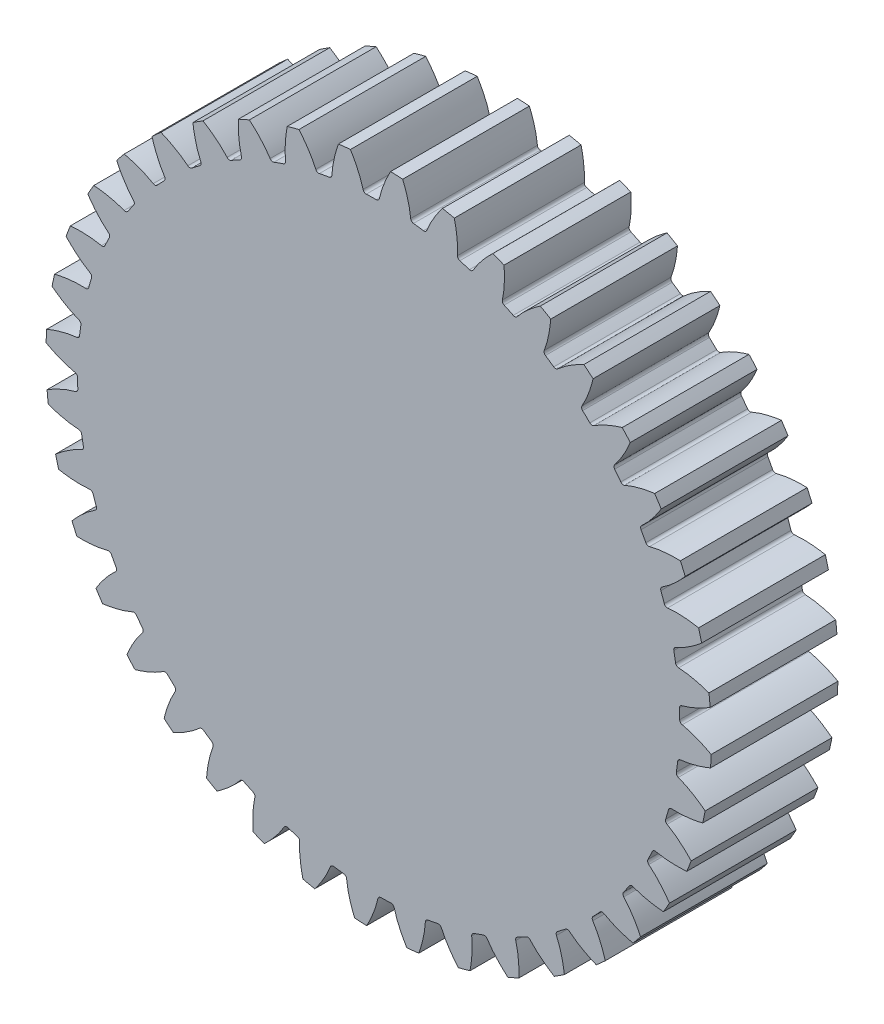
SolidWorks part; units mm, degrees
ref_plane "Płaszczyzna przednia" through (0, 0, 0) normal (0, 0, 1) x (1, 0, 0)
ref_plane "Płaszczyzna górna" through (0, 0, 0) normal (0, 1, 0) x (1, 0, 0)
ref_plane "Płaszczyzna prawa" through (0, 0, 0) normal (1, 0, 0) x (0, 0, -1)
sketch "Szkic1" plane through (0, 0, 0) normal (0, 0, 1) x (1, 0, 0)
  line L0 (0, 0) -> (-93.9693, 0) construction
  circle A0 centre (0, 0) radius 93.9693 construction
  spline S0 degree 4 poles (0, 93.9693) (0.0015, 94.0387) (0.0101, 94.2334) (0.0445, 94.6007) (0.126, 95.1975) (0.267, 95.9534) (0.4917, 96.9232) (0.8105, 98.0546) (1.2174, 99.2846) (1.7197, 100.6057) (2.2738, 101.9074) (2.8741, 103.1883) (3.5163, 104.4488) (4.3424, 105.9534) (5.406, 107.7297) (6.741, 109.7534) (8.3808, 111.9958) (10.1543, 114.2008) (12.0208, 116.3274) (13.7282, 118.1203) (15.2401, 119.609) (16.5303, 120.8179) (17.5798, 121.7661) (18.9128, 122.9278) (20.2722, 124.0581) (21.6573, 125.1577) (23.347, 126.4399) (24.6361, 127.3747) (25.7945, 128.1829) (26.8233, 128.877) (27.3989, 129.2594) (28.1628, 129.7572) (28.7771, 130.1498) (29.8873, 130.847) (30.7127, 131.3425) (31.6087, 131.8792) (32.0316, 132.1195) (32.3237, 132.29) knots 0 0 0 0 0 0.005377 0.015084 0.028532 0.04661 0.064855 0.092111 0.119476 0.146842 0.174209 0.201575 0.228941 0.256307 0.307035 0.361767 0.4165 0.471232 0.525964 0.580697 0.608063 0.635429 0.662795 0.690161 0.744894 0.77226 0.799626 0.854358 0.868042 0.881725 0.895408 0.909091 0.931818 0.954545 0.977273 1 1 1 1 1 construction
  spline S1 degree 4 poles (0, 93.9693) (0.0015, 94.0387) (0.0101, 94.2334) (0.0445, 94.6007) (0.126, 95.1975) (0.267, 95.9534) (0.4917, 96.9232) (0.8105, 98.0546) (1.2174, 99.2846) (1.7197, 100.6057) (2.2738, 101.9074) (2.8741, 103.1883) (3.5163, 104.4488) (4.3424, 105.9534) (5.406, 107.7297) (6.741, 109.7534) (8.3808, 111.9958) (10.1543, 114.2008) (12.0208, 116.3274) (13.7282, 118.1203) (15.2401, 119.609) (16.5303, 120.8179) (17.5798, 121.7661) (18.9128, 122.9278) (20.2722, 124.0581) (21.6573, 125.1577) (23.347, 126.4399) (24.6361, 127.3747) (25.7945, 128.1829) (26.8233, 128.877) (27.3989, 129.2594) (27.8906, 129.5798) (28.1654, 129.7573) (28.3006, 129.8442) knots 0 0 0 0 0 0.005377 0.015084 0.028532 0.04661 0.064855 0.092111 0.119476 0.146842 0.174209 0.201575 0.228941 0.256307 0.307035 0.361767 0.4165 0.471232 0.525964 0.580697 0.608063 0.635429 0.662795 0.690161 0.744894 0.77226 0.799626 0.854358 0.868042 0.881725 0.895408 0.909091 0.909091 0.909091 0.909091 0.909091
sketch "Szkic2" plane through (0, 0, 0) normal (0, 0, 1) x (1, 0, 0)
  circle A0 centre (0, 0) radius 105
extrude "Dodanie-wyciągnięcie1" add sketch "Szkic2" along normal blind 40
sketch "Szkic3" plane through (0, 0, 40) normal (0, 0, 1) x (1, 0, 0)
  line L0 (0, 0) -> (-2.4362, 99.9703) construction
  arc A0 (1.4904, 99.9889) -> (-6.359, 99.7976) centre (0, 0) ccw construction
  arc A1 (0.1024, 94.9999) -> (-4.7297, 94.8822) centre (0, 0) ccw
  circle A2 centre (0, 0) radius 105 construction
  arc A3 (3.7858, 104.9317) -> (-8.8925, 104.6228) centre (0, 0) ccw
  spline S0 degree 4 poles (999.9083, 80.4305) (29.6931, 84.0474) (0.578, 87.737) (-0.3869, 91.4411) (0.126, 95.1975) (0.267, 95.9534) (0.4917, 96.9232) (0.8105, 98.0546) (1.2174, 99.2846) (1.7197, 100.6057) (2.2738, 101.9074) (2.8741, 103.1883) (3.5163, 104.4488) (4.3424, 105.9534) (5.406, 107.7297) (6.741, 109.7534) (8.3808, 111.9958) (10.1543, 114.2008) (12.0208, 116.3274) (13.7282, 118.1203) (15.2401, 119.609) (16.5303, 120.8179) (17.5798, 121.7661) (18.9128, 122.9278) (20.2722, 124.0581) (21.6573, 125.1577) (23.347, 126.4399) (24.6361, 127.3747) (25.7945, 128.1829) (26.8233, 128.877) (29.3599, 130.5619) (33.5926, 133.1853) (1.2449, 112.2039) (869.9252, 669.6753) knots -0.246751 -0.246751 -0.246751 -0.246751 -0.246751 0.005377 0.015084 0.028532 0.04661 0.064855 0.092111 0.119476 0.146842 0.174209 0.201575 0.228941 0.256307 0.307035 0.361767 0.4165 0.471232 0.525964 0.580697 0.608063 0.635429 0.662795 0.690161 0.744894 0.77226 0.799626 0.854358 0.868042 0.881725 0.895408 1.095536 1.095536 1.095536 1.095536 1.095536 only from (0, 93.9693) to (28.3006, 129.8442) construction
  spline S1 degree 4 poles (0.1024, 94.9999) (0.1186, 95.1083) (0.1728, 95.4471) (0.2815, 96.0159) (0.4917, 96.9232) (0.8105, 98.0546) (1.2174, 99.2846) (1.7197, 100.6057) (2.2738, 101.9074) (2.8577, 103.1534) (3.3208, 104.0649) (3.6352, 104.655) (3.7858, 104.9317) knots 0.020053 0.020053 0.020053 0.020053 0.020053 0.028532 0.04661 0.064855 0.092111 0.119476 0.146842 0.174209 0.201575 0.225957 0.225957 0.225957 0.225957 0.225957
  spline S2 degree 4 poles (-4.7297, 94.8822) (-4.7511, 94.9896) (-4.8218, 95.3254) (-4.958, 95.8882) (-5.2122, 96.7842) (-5.5858, 97.8988) (-6.052, 99.1075) (-6.6181, 100.4025) (-7.2349, 101.6756) (-7.8788, 102.8918) (-8.3857, 103.7797) (-8.7286, 104.3537) (-8.8925, 104.6228) knots 0.020053 0.020053 0.020053 0.020053 0.020053 0.028532 0.04661 0.064855 0.092111 0.119476 0.146842 0.174209 0.201575 0.225957 0.225957 0.225957 0.225957 0.225957
extrude "Wytnij-wyciągnięcie1" cut sketch "Szkic3" against normal through all contours S2 A3 S1 A1
fillet "Zaokrąglenie1" radius 1 2 edges at (0.1024, 94.9999, 20) (-4.7297, 94.8822, 20)
pattern_circular "Szyk kołowy1" count 40 over 360 about axis through (0, 0, 40) along (0, 0, -1) of "Wytnij-wyciągnięcie1", "Zaokrąglenie1"
sketch "Szkic4" [suppressed] plane through (0, 0, 40) normal (0, 0, 1) x (1, 0, 0)
  line L0 (0, 0) -> (-3.904, 53.8587) construction
  line L1 (-7.3179, 50.213) -> (0, 50.7434)
  arc A0 (4.0821, 59.861) -> (-12.6723, 58.6465) centre (0, 0) ccw
  arc A1 (0.8048, 53.994) -> (-8.5831, 53.3135) centre (0, 0) ccw construction
  circle A2 centre (0, 0) radius 48 construction
  spline S0 degree 4 poles (1999.8117, 39.8954) (40.5779, 43.1261) (0.7793, 45.9501) (-0.3009, 48.7046) (0.068, 51.4067) (0.1442, 51.8148) (0.2655, 52.3385) (0.4377, 52.9495) (0.6574, 53.6137) (0.9286, 54.3271) (1.2278, 55.03) (1.552, 55.7217) (1.8988, 56.4023) (2.3449, 57.2148) (2.9192, 58.174) (3.6402, 59.2669) (4.5256, 60.4777) (5.4834, 61.6685) (6.491, 62.8166) (7.4136, 63.7852) (8.2291, 64.5885) (8.9273, 65.2423) (9.4914, 65.7526) (10.2164, 66.3833) (10.941, 66.9876) (11.7034, 67.5906) (12.594, 68.2689) (13.4071, 68.8553) (16.247, 70.8396) (22.2811, 74.4519) (-32.9346, 38.4752) (1698.6965, 1149.6096) knots -0.344173 -0.344173 -0.344173 -0.344173 -0.344173 0.005377 0.015084 0.028532 0.04661 0.064855 0.092111 0.119476 0.146842 0.174209 0.201575 0.228941 0.256307 0.307035 0.361767 0.4165 0.471232 0.525964 0.580697 0.608063 0.635429 0.662795 0.690161 0.744894 0.77226 0.799626 0.854358 0.881725 1.316021 1.316021 1.316021 1.316021 1.316021 only from (0, 50.7434) to (15.2823, 70.1159) construction
  spline S1 degree 4 poles (0, 50.7434) (0.0008, 50.7809) (0.0055, 50.8861) (0.024, 51.0844) (0.068, 51.4067) (0.1442, 51.8148) (0.2655, 52.3385) (0.4377, 52.9495) (0.6574, 53.6137) (0.9286, 54.3271) (1.2278, 55.03) (1.552, 55.7217) (1.8988, 56.4023) (2.3449, 57.2148) (2.9192, 58.174) (3.4304, 58.9489) (3.8556, 59.5508) (4.0815, 59.8601) (4.0821, 59.861) knots 0 0 0 0 0 0.005377 0.015084 0.028532 0.04661 0.064855 0.092111 0.119476 0.146842 0.174209 0.201575 0.228941 0.256307 0.307035 0.361767 0.361924 0.361924 0.361924 0.361924 0.361924
  spline S2 degree 4 poles (-7.3179, 50.213) (-7.3241, 50.25) (-7.3439, 50.3533) (-7.3909, 50.5469) (-7.4809, 50.8595) (-7.6151, 51.2524) (-7.8107, 51.7531) (-8.0692, 52.3329) (-8.3824, 52.9584) (-8.7537, 53.6253) (-9.1511, 54.2776) (-9.5716, 54.9154) (-10.013, 55.5389) (-10.5716, 56.2786) (-11.2782, 57.1449) (-11.8958, 57.838) (-12.4033, 58.3723) (-12.6715, 58.6457) (-12.6723, 58.6465) knots 0 0 0 0 0 0.005377 0.015084 0.028532 0.04661 0.064855 0.092111 0.119476 0.146842 0.174209 0.201575 0.228941 0.256307 0.307035 0.361767 0.361924 0.361924 0.361924 0.361924 0.361924
extrude "Wytnij-wyciągnięcie2" [suppressed] cut sketch "Szkic4" against normal through all
sketch "Szkic5" [suppressed] plane through (0, 0, 40) normal (0, 0, 1) x (1, 0, 0)
  line L0 (-7.3179, 50.213) -> (0, 50.7434) construction
  line L1 (-7.3179, 50.213) -> (0, 50.7434)
  arc A2 (-7.3179, 50.213) -> (-4.4598, 47.7924) centre (-4.7033, 50.4025) ccw
  circle A3 centre (0, 0) radius 48 construction
  arc A4 (0, 50.7434) -> (-2.4792, 47.9359) centre (-2.6146, 50.5539) cw
  arc A5 (-4.4598, 47.7924) -> (-2.4792, 47.9359) centre (0, 0) cw
extrude "Wytnij-wyciągnięcie3" [suppressed] cut sketch "Szkic5" against normal through all
pattern_circular "Szyk kołowy2" [suppressed] count 40 over 360
other "Gięcie1" [suppressed] parameters "D0"=30, "D1"=0, "D2"=0
equation "\"Moduł\" = 5"
equation "\"Liczba zębów\" = 40"
equation "\"Kąt zarysu\"= 20"
equation "\"Średnica podziałowa\"= \"Moduł\" * \"Liczba zębów\""
equation "\"Średnica głowy zęba\"= \"Średnica podziałowa\" + 2 * \"Moduł\""
equation "\"Średnica stopy zęba\"= \"Średnica podziałowa\" - 2 * \"Moduł\""
equation "\"Średnica zasadnicza\"= \"Średnica podziałowa\" * cos ( \"Kąt zarysu\" )"
equation "\"R.zasadniczego@Szkic1\" = \"Średnica zasadnicza\" / 2"
equation "\"Średnica głowy zęba@Szkic2\"= \"Średnica głowy zęba\""
equation "\"Szerokość zęba@Szkic3\"= \"Moduł\" * 3.1415 / 2"
equation "\"Liczba zębów@Szyk kołowy1\"= \"Liczba zębów\""
equation "\"Wytnij-wyciągnięcie1\"= if ( \"Średnica zasadnicza\" < \"Średnica stopy zęba\" , \"unsuppressed\" , \"suppressed\" )"
equation "\"Szkic3\"= IIF ( \"Średnica zasadnicza\" < \"Średnica stopy zęba\" , \"unsuppressed\" , \"suppressed\" )"
equation "\"Zaokrąglenie1\"= IIF ( \"Średnica zasadnicza\" < \"Średnica stopy zęba\" , \"unsuppressed\" , \"suppressed\" )"
equation "\"Szyk kołowy1\"= IIF ( \"Średnica zasadnicza\" < \"Średnica stopy zęba\" , \"unsuppressed\" , \"suppressed\" )"
equation "\"Średnica głowy zęba@Szkic4\"= \"Średnica głowy zęba\""
equation "\"Średnica stopy zęba@Szkic4\"= \"Średnica stopy zęba\""
equation "\"Średnica podziałowa@Szkic4\"= \"Średnica podziałowa\""
equation "\"Szerokość zęba@Szkic4\"= \"Moduł\" * 3.1415 / 2"
equation "\"Liczba zębów@Szyk kołowy2\"= \"Liczba zębów\""
equation "\"Wytnij-wyciągnięcie2\"= if ( \"Średnica zasadnicza\" > \"Średnica stopy zęba\" , \"unsuppressed\" , \"suppressed\" )"
equation "\"Szkic4\"= IIF ( \"Średnica zasadnicza\" > \"Średnica stopy zęba\" , \"unsuppressed\" , \"suppressed\" )"
equation "\"Szyk kołowy2\"= if ( \"Średnica zasadnicza\" > \"Średnica stopy zęba\" , \"unsuppressed\" , \"suppressed\" )"
equation "\"Wytnij-wyciągnięcie3\"= IIF ( \"Średnica zasadnicza\" > \"Średnica stopy zęba\" , \"unsuppressed\" , \"suppressed\" )"
equation "\"Szkic5\"= IIF ( \"Średnica zasadnicza\" > \"Średnica stopy zęba\" , \"unsuppressed\" , \"suppressed\" )"
equation "\"X.końca@Szkic1\"= \"R.zasadniczego@Szkic1\" * sin ( 57.2958 ) - \"R.zasadniczego@Szkic1\" * cos ( 57.2958 )"
